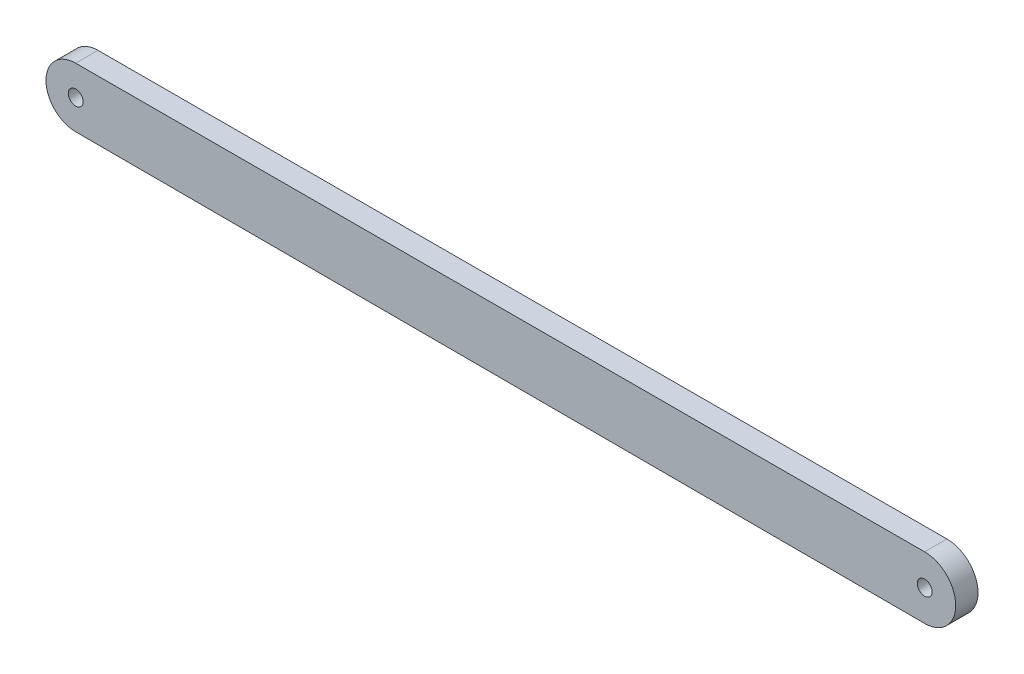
SolidWorks part; units mm, degrees
ref_plane "Front Plane" through (0, 0, 0) normal (0, 0, 1) x (1, 0, 0)
ref_plane "Top Plane" through (0, 0, 0) normal (0, 1, 0) x (1, 0, 0)
ref_plane "Right Plane" through (0, 0, 0) normal (1, 0, 0) x (0, 0, -1)
sketch "Sketch1" plane through (0, 0, 0) normal (0, 0, 1) x (1, 0, 0)
  line L0 (-0.0061, 4) -> (114.2936, 4.175)
  line L5 (114.2936, -4.175) -> (-0.0061, -4)
  circle A4 centre (0, 0) radius 1
  circle A5 centre (114.3, 0) radius 1
  arc A6 (-0.0061, -4) -> (-0.0061, 4) centre (0, 0) cw
  arc A7 (114.2936, -4.175) -> (114.2936, 4.175) centre (114.3, 0) ccw
  dimension "D3" = 114.3
  dimension "D4" = 4
  dimension "D1" = 2
  dimension "D2" = 2
  dimension "D5" = 4.175
extrude "Boss-Extrude1" add sketch "Sketch1" along normal blind 3
